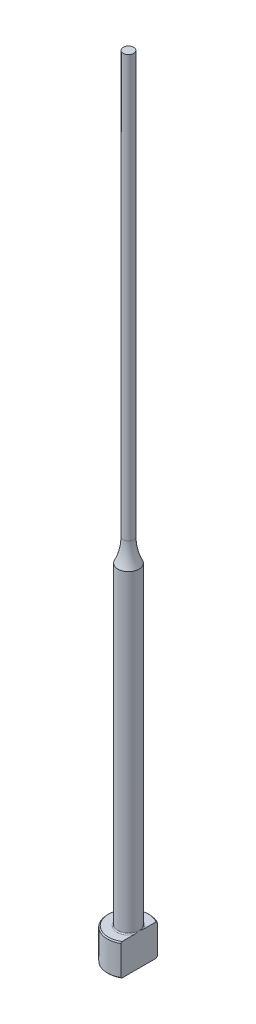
SolidWorks part; units mm, degrees
ref_plane "Front Plane" through (0, 0, 0) normal (0, 0, 1) x (1, 0, 0)
ref_plane "Top Plane" through (0, 0, 0) normal (0, 1, 0) x (1, 0, 0)
ref_plane "Right Plane" through (0, 0, 0) normal (1, 0, 0) x (0, 0, -1)
sketch "Sketch1" plane through (0, 0, 0) normal (0, 0, 1) x (1, 0, 0)
  line L0 (0, 259.9588) -> (0, -15.1925) construction
  line L1 (0, 0) -> (-4, 0)
  line L2 (-4, 0) -> (-4, 6)
  line L3 (-4, 6) -> (-2, 6)
  line L4 (-1, 70) -> (-1, 150)
  line L5 (-1, 150) -> (0, 150)
  line L6 (0, 150) -> (0, 0)
  line L7 (-2, 6) -> (-2, 65.6411)
  arc A0 (-2, 65.6411) -> (-1, 70) centre (-11, 70) ccw
  point P13 (-2, 0)
  dimension "D1" = 10
  dimension "L" = 150
  dimension "H" = 8
  dimension "T" = 6
  dimension "D" = 2
  dimension "B" = 4
  dimension "S" = 70
revolve "Revolve1" add sketch "Sketch1" angle 360 about L0
chamfer "Chamfer1" distance 0.2 angle 45 2 edges at (0, 6, 4) (0, 0, 4)
fillet "Fillet1" radius 0.2 1 edges at (0, 6, 2)
sketch "Sketch2" plane through (0, 0, 0) normal (0, 1, 0) x (1, 0, 0)
  line L0 (2, -3.4641) -> (2, 3.4641)
  circle A0 centre (0, 0) radius 4 construction
  arc A1 (2, -3.4641) -> (2, 3.4641) centre (0, 0) ccw
  circle A2 centre (0, 0) radius 2 construction
extrude "Keyed Head" cut sketch "Sketch2" along normal through all
